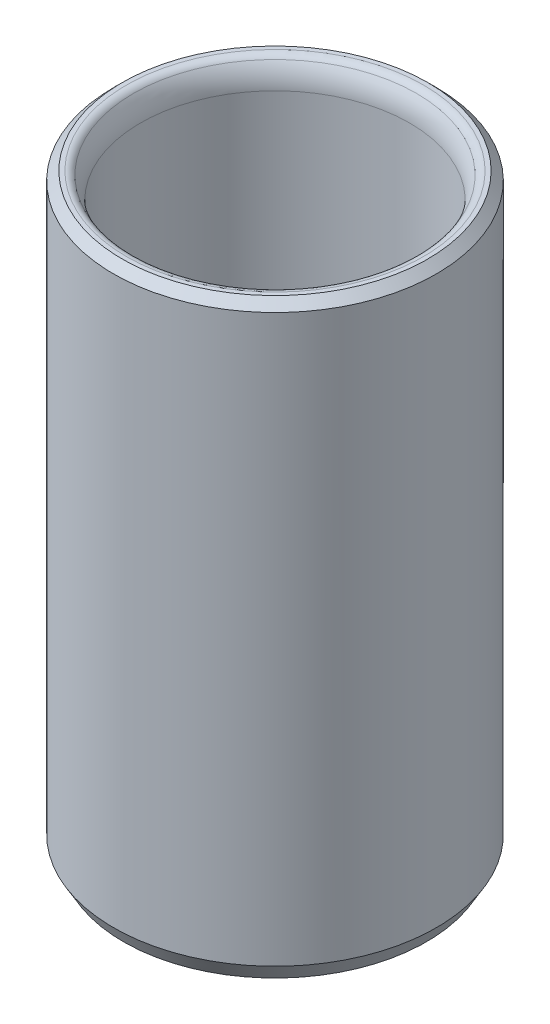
SolidWorks part; units mm, degrees
ref_plane "Front Plane" through (0, 0, 0) normal (0, 0, 1) x (1, 0, 0)
ref_plane "Top Plane" through (0, 0, 0) normal (0, 1, 0) x (1, 0, 0)
ref_plane "Right Plane" through (0, 0, 0) normal (1, 0, 0) x (0, 0, -1)
sketch "Sketch1" plane through (0, 0, 0) normal (0, 0, 1) x (1, 0, 0)
  line L0 (0, -34.925) -> (0, -9.525) construction
  line L1 (0, -10.4775) -> (0, 10.4775) construction
  line L2 (0, -34.925) -> (8.9384, -34.925)
  line L3 (9.525, -33.909) -> (9.525, -0.508)
  line L4 (9.017, 0) -> (8.7644, 0)
  line L5 (7.9375, -1.524) -> (7.9375, -22.479)
  line L6 (7.4295, -22.987) -> (0, -22.987)
  line L7 (0, -22.987) -> (0, -34.925)
  line L9 (9.525, -0.508) -> (9.017, 0)
  line L10 (8.9384, -34.925) -> (9.525, -33.909)
  arc A0 (8.3475, -0.2177) -> (7.9375, -1.524) centre (10.2235, -1.524) ccw
  arc A1 (8.3475, -0.2177) -> (8.7644, 0) centre (8.7644, -0.508) cw
  arc A2 (7.4295, -22.987) -> (7.9375, -22.479) centre (7.4295, -22.479) ccw
  point P5 (9.525, 0)
  point P6 (9.525, -34.925)
  point P11 (9.525, -34.925)
  dimension "D7" = 2.286
  dimension "D5" = 0.508
  dimension "D11" = 0.508
  dimension "D1" = 25.4
  dimension "D2" = 15.875
  dimension "D3" = 34.925
  dimension "D4" = 19.05
  dimension "D6" = 1.524
  dimension "D12" = 30
  dimension "D8" = 1.016
  dimension "D10" = 22.987
revolve "Revolve1" add sketch "Sketch1" angle 360 about L0
hole_wizard "5/16-18 Tapped Hole1" positions "Sketch2" profile "Sketch3" tap size "5/16-18" standard "ANSI Inch"
sketch "Sketch2" plane through (0, -22.987, 0) normal (0, 1, 0) x (1, 0, 0)
  point P0 (0, 0)
sketch "Sketch3" plane through (0, -22.987, 0) normal (1, 0, 0) x (0, 0, 1)
  line L0 (0, 0) -> (0, 21.4735)
  line L1 (0, 21.4735) -> (3.3147, 19.4818)
  line L2 (3.3147, 19.4818) -> (3.3147, 0)
  line L5 (3.3147, 0) -> (0, 0)
  line L10 (0, 21.4735) -> (-3.3147, 19.4818) construction
  line L11 (0, -6.35) -> (0, 107.95) construction
  dimension "Tap Drill Dia." = 6.6294
  dimension "Tap Drill Depth" = 19.4818
  dimension "Drill Angle" = 118
sketch "Sketch4" plane through (0, 0, 0) normal (0, 1, 0) x (1, 0, 0)
  line L1 (-9.525, 1.5875) -> (-9.398, 1.5875)
  line L2 (-9.525, 1.5875) -> (-9.525, -1.5875)
  line L3 (-9.525, -1.5875) -> (-9.398, -1.5875)
  line L4 (-9.398, 1.5875) -> (-9.398, -1.5875)
  circle A0 centre (0, 0) radius 9.525 construction
  dimension "D1" = 0.127
  dimension "D2" = 3.175
  dimension "D3" = 1.5875
extrude "Cut-Extrude1" cut sketch "Sketch4" against normal through all
sketch "Sketch5" plane through (-9.398, 0, 0) normal (-1, 0, 0) x (0, 0, 1)
  line L0 (8.7644, 0) -> (-8.7644, 0) construction
  circle A0 centre (0, -19.05) radius 0.7937
  dimension "D1" = 19.05
  dimension "D2" = 1.5875
extrude "Cut-Extrude2" cut sketch "Sketch5" against normal blind 2.54
